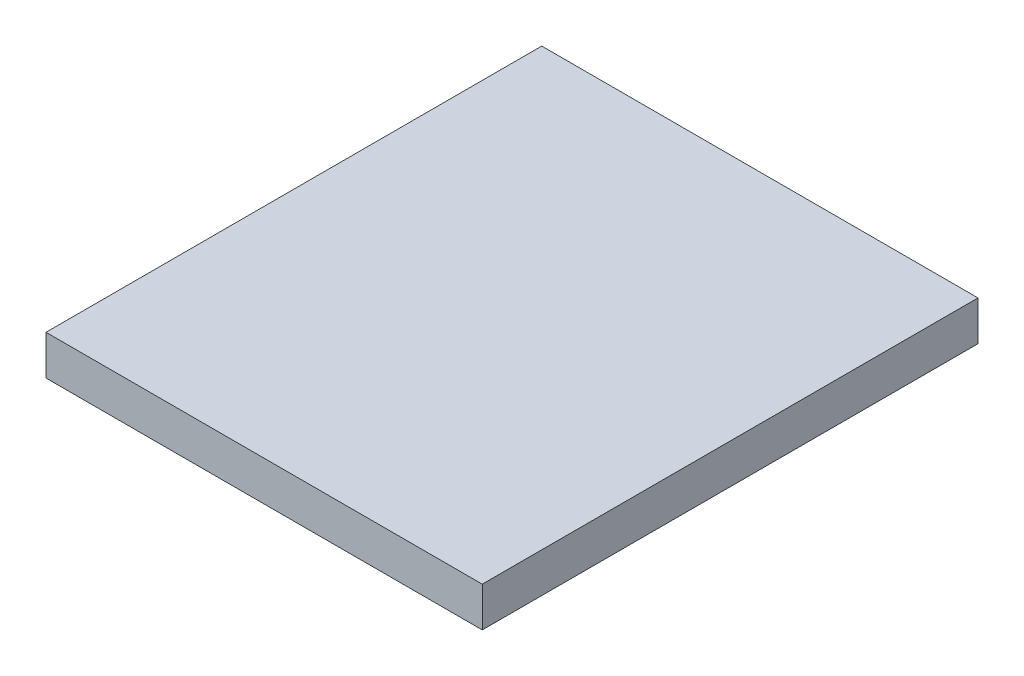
SolidWorks part; units mm, degrees
ref_plane "Front Plane" through (0, 0, 0) normal (0, 0, 1) x (1, 0, 0)
ref_plane "Top Plane" through (0, 0, 0) normal (0, 1, 0) x (1, 0, 0)
ref_plane "Right Plane" through (0, 0, 0) normal (1, 0, 0) x (0, 0, -1)
sketch "Sketch1" plane through (0, 0, 0) normal (0, 1, 0) x (1, 0, 0)
  line L1 (-220, -250) -> (220, -250)
  line L2 (-220, -250) -> (-220, 250)
  line L3 (-220, 250) -> (220, 250)
  line L4 (220, -250) -> (220, 250)
  line L5 (-220, -250) -> (220, 250) construction
  line L6 (-220, 250) -> (220, -250) construction
  point P0 (0, 0)
  dimension "D1" = 500
  dimension "D2" = 440
extrude "Boss-Extrude1" add sketch "Sketch1" along normal blind 40
